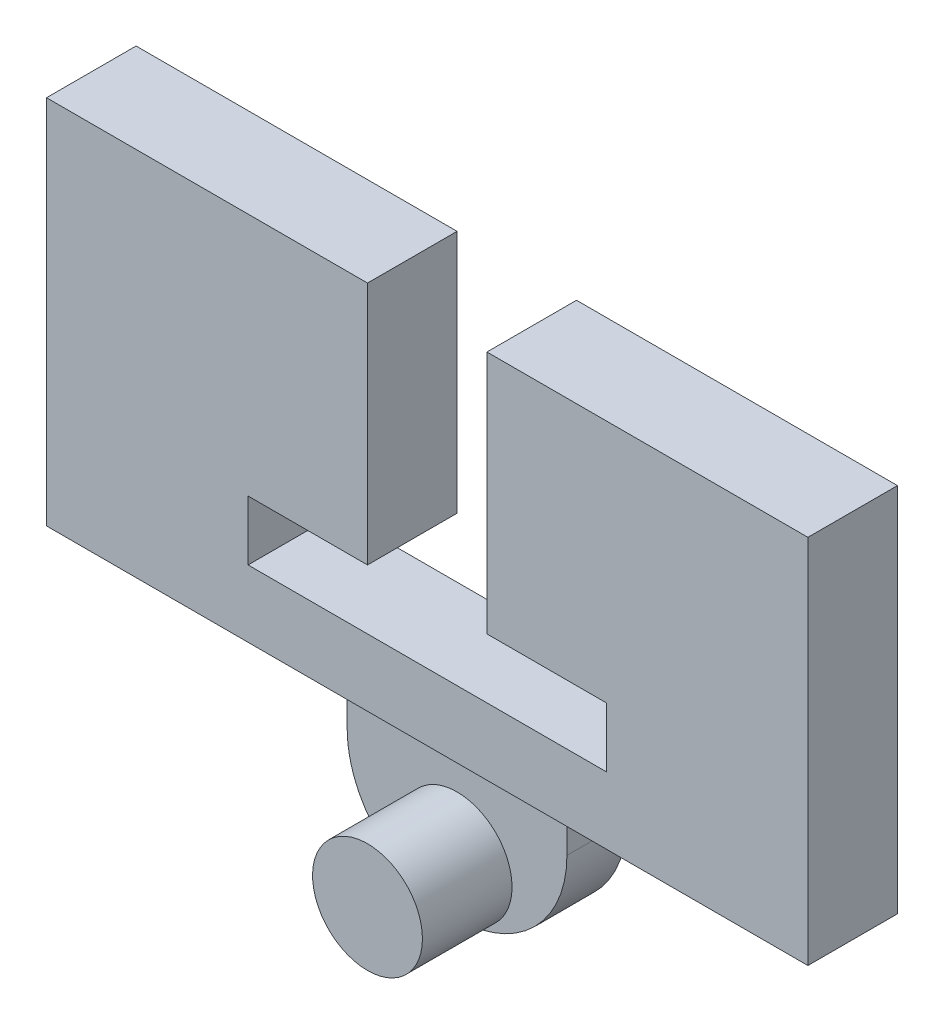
SolidWorks part; units mm, degrees
ref_plane "Front Plane" through (0, 0, 0) normal (0, 0, 1) x (1, 0, 0)
ref_plane "Top Plane" through (0, 0, 0) normal (0, 1, 0) x (1, 0, 0)
ref_plane "Right Plane" through (0, 0, 0) normal (1, 0, 0) x (0, 0, -1)
sketch "Sketch1" plane through (0, 0, 0) normal (0, 0, 1) x (1, 0, 0)
  line L2 (-23.3664, 23.3664) -> (-23.3664, 35.0496)
  line L3 (-23.3664, 35.0496) -> (23.3664, 35.0496)
  line L4 (23.3664, 23.3664) -> (23.3664, 35.0496)
  arc A1 (23.3664, 23.3664) -> (-23.3664, 23.3664) centre (0, 23.3664) cw
  point P0 (0, 35.0496)
extrude "Section B" add sketch "Sketch1" along normal blind 12.7
sketch "Sketch3" plane through (0, 0, 12.7) normal (0, 0, 1) x (1, 0, 0)
  line L1 (0, -13.97) -> (0, 13.97) construction
  circle A1 centre (0, 11.6832) radius 11.6832
extrude "Section A" add sketch "Sketch3" along normal blind 19.05
sketch "Sketch4" plane through (0, 0, 0) normal (0, 0, 1) x (1, 0, 0)
  line L0 (0, 14.478) -> (0, 42.8606) construction
  line L2 (-80.9625, 35.0496) -> (80.9625, 35.0496)
  line L3 (-80.9625, 35.0496) -> (-80.9625, 49.2966)
  line L4 (-80.9625, 49.2966) -> (80.9625, 49.2966)
  line L5 (80.9625, 35.0496) -> (80.9625, 49.2966)
  line L6 (23.3664, 35.0496) -> (-23.3664, 35.0496) construction
extrude "Section C" add sketch "Sketch4" along normal blind 19.05
sketch "Sketch5" plane through (0, 0, 0) normal (0, 0, 1) x (1, 0, 0)
  line L0 (0, -13.97) -> (0, 13.97) construction
  line L1 (80.9625, 49.2966) -> (38.1, 49.2966)
  line L2 (80.9625, 49.2966) -> (80.9625, 61.9966)
  line L3 (80.9625, 61.9966) -> (38.1, 61.9966)
  line L4 (38.1, 49.2966) -> (38.1, 61.9966)
  line L5 (-80.9625, 61.9966) -> (-38.1, 61.9966)
  line L6 (-38.1, 49.2966) -> (-38.1, 61.9966)
  line L7 (-80.9625, 49.2966) -> (-38.1, 49.2966)
  line L8 (-80.9625, 49.2966) -> (-80.9625, 61.9966)
extrude "Section D" add sketch "Sketch5" along normal blind 19.05
sketch "Sketch6" plane through (0, 0, 0) normal (0, 0, 1) x (1, 0, 0)
  line L0 (0, -13.97) -> (0, 13.97) construction
  line L1 (80.9625, 61.9966) -> (12.7, 61.9966)
  line L2 (80.9625, 61.9966) -> (80.9625, 113.9209)
  line L3 (80.9625, 113.9209) -> (12.7, 113.9209)
  line L4 (12.7, 61.9966) -> (12.7, 113.9209)
  line L5 (-80.9625, 113.9209) -> (-12.7, 113.9209)
  line L6 (-12.7, 61.9966) -> (-12.7, 113.9209)
  line L7 (-80.9625, 61.9966) -> (-12.7, 61.9966)
  line L8 (-80.9625, 61.9966) -> (-80.9625, 113.9209)
extrude "Section E" add sketch "Sketch6" along normal blind 19.05
equation "\"F\"= 250"
equation "\"E\"= 600000"
equation "\"Ts\"= 20000"
equation "\"SF\"= 4"
equation "\"delta\"= 0.005in"
equation "\"Al\"= 0.75in"
equation "\"Ad\"= ( ( 2 * \"F\" * ( ( \"Al\" ) ^ 3 ) * \"SF\" * 64 ) / ( 8 * \"E\" * \"delta\" * pi ) ) ^ ( 1 / 4 )"
equation "\"Bl\"= ( 2 * \"F\" * \"Bh\" * \"SF\" ) / ( \"Bd\" * \"E\" * \"delta\" )"
equation "\"Bh\"= \"Ad\" + \"Ad\" / 2"
equation "\"Bd\"= 0.5"
equation "\"Dl\"= \"Al\""
equation "\"Dh\"= 0.5in"
equation "\"Dw\"= ( \"F\" * ( ( \"Dl\" ) ^ 3 ) * 12 * \"SF\" ) / ( 8 * \"delta\" * \"E\" * ( \"Dh\" ) ^ 3 )"
equation "\"Cl\"= \"Al\""
equation "\"Cw\"= 3 + ( 2 * \"Dw\" )"
equation "\"Ch\"= ( ( 2 * \"F\" * ( ( \"Cl\" ) ^ 3 ) * \"SF\" * 12 ) / ( 3 * \"E\" * \"delta\" * \"Cw\" ) ) ^ ( 1 / 3 )"
equation "\"El\"= \"Al\""
equation "\"Ew_calc\"= \"Dw\""
equation "\"Ew\"= \"Ew_calc\" + 1"
equation "\"Eh\"= ( ( \"F\" * ( \"Ew_calc\" ^ 3 ) * 12 * \"SF\" ) / ( 3 * \"E\" * \"delta\" * \"El\" ) ) ^ ( 1 / 3 )"
equation "\"D1@Section B\"=\"Bd\""
equation "\"D1@Sketch3\"=\"Ad\""
equation "\"D1@Section A\"=\"Al\""
equation "\"D1@Sketch4\"=\"Cw\""
equation "\"D2@Sketch4\"=\"Ch\""
equation "\"D1@Section C\"=\"Cl\""
equation "\"D1@Sketch5\"=\"Dh\""
equation "\"D2@Sketch5\"=\"Dw\""
equation "\"D1@Section D\"=\"Dl\""
equation "\"D1@Sketch6\"=\"Eh\""
equation "\"D2@Sketch6\"=\"Ew\""
equation "\"D1@Section E\"=\"El\""
equation "\"D2@Sketch1\"=\"Bh\""
equation "\"D4@Sketch1\"=\"Bl\""
equation "\"D3@Sketch1\"=\"Bh\"-\"Ad\""
